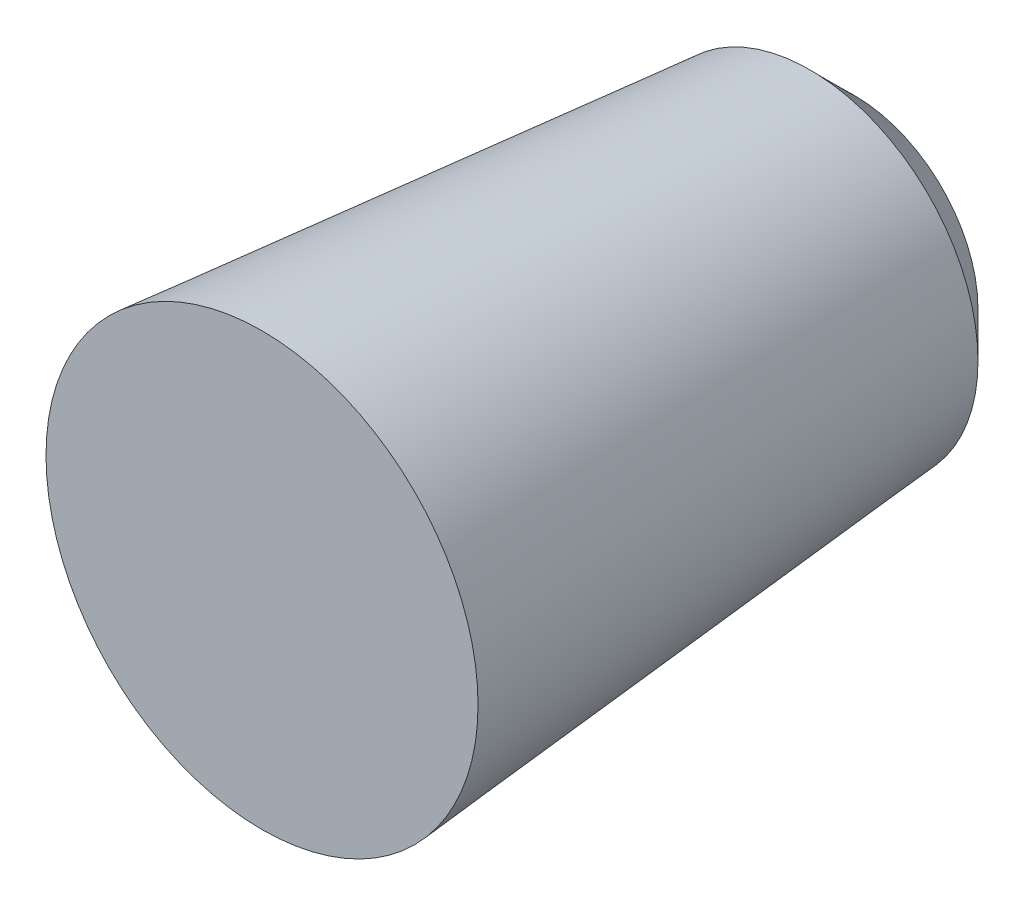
SolidWorks part; units mm, degrees
ref_plane "Plan de face" through (0, 0, 0) normal (0, 0, 1) x (1, 0, 0)
ref_plane "Plan de dessus" through (0, 0, 0) normal (0, 1, 0) x (1, 0, 0)
ref_plane "Plan de droite" through (0, 0, 0) normal (1, 0, 0) x (0, 0, -1)
sketch "Esquisse1" plane through (0, 0, 0) normal (0, 0, 1) x (1, 0, 0)
  circle A0 centre (32.0605, -76.1769) radius 24
  dimension "D1" = 48
extrude "Boss.-Extru.1" add sketch "Esquisse1" along normal up to surface (86.6814 mm away) draft 5
chamfer "Chanfrein1" distance 6 angle 45 1 edges at (56.0605, -76.1769, 0)
